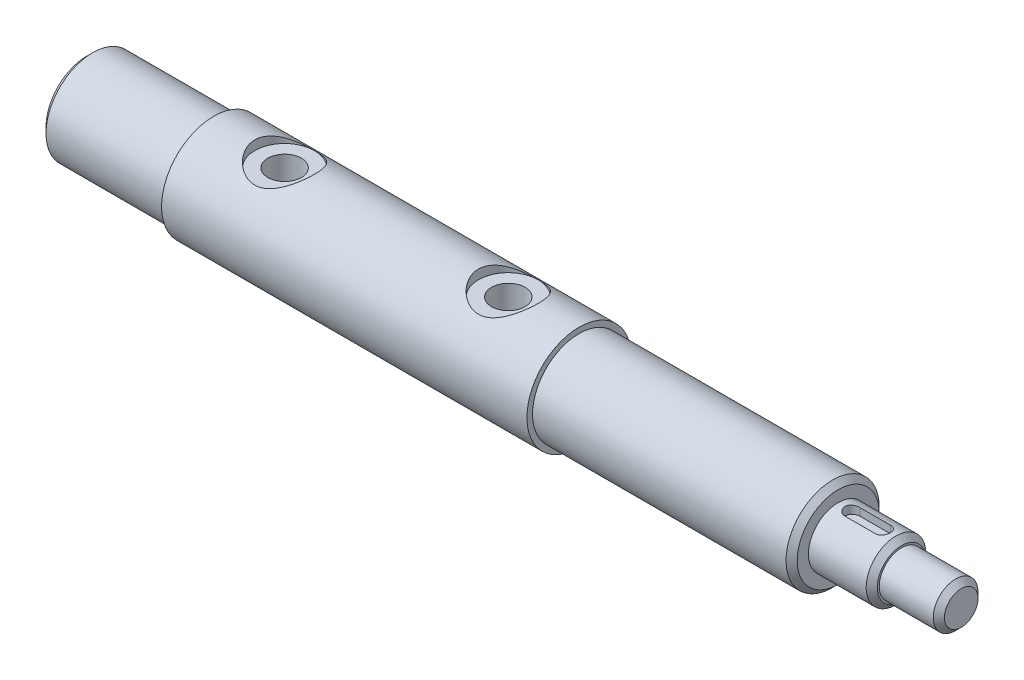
SolidWorks part; units mm, degrees
ref_plane "Plan1" through (0, 0, 0) normal (0, 0, 1) x (1, 0, 0)
ref_plane "Plan2" through (0, 0, 0) normal (0, 1, 0) x (1, 0, 0)
ref_plane "Plan3" through (0, 0, 0) normal (1, 0, 0) x (0, 0, -1)
sketch "Esquisse1" plane through (0, 0, 0) normal (0, 0, 1) x (1, 0, 0)
  line L0 (-100, 12.5) -> (-100, 0)
  line L3 (101.5, 12.5) -> (32, 12.5)
  line L4 (101.5, 12.5) -> (101.5, 8)
  line L5 (101.5, 8) -> (118.5, 8)
  line L6 (118.5, 8) -> (118.5, 6)
  line L7 (118.5, 6) -> (134.5, 6)
  line L8 (134.5, 6) -> (134.5, 0)
  line L9 (134.5, 0) -> (-100, 0)
  line L10 (-100, 0) -> (-130, 0) construction
  line L11 (32, 12.5) -> (32, 14)
  line L12 (32, 14) -> (-66, 14)
  line L13 (-66, 14) -> (-66, 12.5)
  line L14 (-66, 12.5) -> (-100, 12.5)
  dimension "D1" = 6
  dimension "D2" = 8
  dimension "D3" = 12.5
  dimension "D4" = 14
  dimension "D5" = 12.5
  dimension "D6" = 34
  dimension "D7" = 98
  dimension "D8" = 69.5
  dimension "D9" = 234.5
  dimension "D10" = 16
revolve "Révolution1" add sketch "Esquisse1" angle 360 about L10
ref_plane "Plan4" through (0, 14, 0) normal (0, 1, 0) x (-1, 0, 0)
sketch "Esquisse2" plane through (0, 14, 0) normal (0, 1, 0) x (-1, 0, 0)
  line L0 (100, -12.5) -> (100, 12.5) construction
  circle A0 centre (47, 0) radius 8
  circle A1 centre (-13, 0) radius 8
  dimension "D1" = 16
  dimension "D2" = 16
  dimension "D3" = 53
  dimension "D4" = 60
extrude "Enlèv. mat.-Extru.1" cut sketch "Esquisse2" against normal blind 2.5
sketch "Esquisse3" plane through (0, 11.5, 0) normal (0, 1, 0) x (-1, 0, 0)
  circle A0 centre (-13, 0) radius 4.5
  arc A1 (-12.5, -7.9844) -> (-12.5, 7.9844) centre (-13, 0) ccw construction
  circle A2 centre (47, 0) radius 4.5
  arc A3 (47.5, -7.9844) -> (47.5, 7.9844) centre (47, 0) ccw construction
  dimension "D1" = 9
  dimension "D2" = 9
extrude "Enlèv. mat.-Extru.2" cut sketch "Esquisse3" against normal through all
chamfer "Chanfrein1" distance 1.5 angle 45
ref_plane "Plan5" through (0, 8, 0) normal (0, 1, 0) x (-1, 0, 0)
sketch "Esquisse4" plane through (0, 8, 0) normal (0, 1, 0) x (-1, 0, 0)
  line L0 (0, 0) -> (-113.5, 0) construction
  line L1 (-118.5, 6.5) -> (-118.5, -6.5) construction
  line L2 (-113.5, 2) -> (-105.3, 2)
  line L3 (-105.3, -2) -> (-113.5, -2)
  arc A0 (-113.5, 2) -> (-113.5, -2) centre (-113.5, 0) ccw
  arc A1 (-105.3, -2) -> (-105.3, 2) centre (-105.3, 0) ccw
  dimension "D1" = 4
  dimension "D2" = 4
  dimension "D3" = 8.2
  dimension "D4" = 5
extrude "Enlèv. mat.-Extru.3" cut sketch "Esquisse4" against normal blind 2.25
